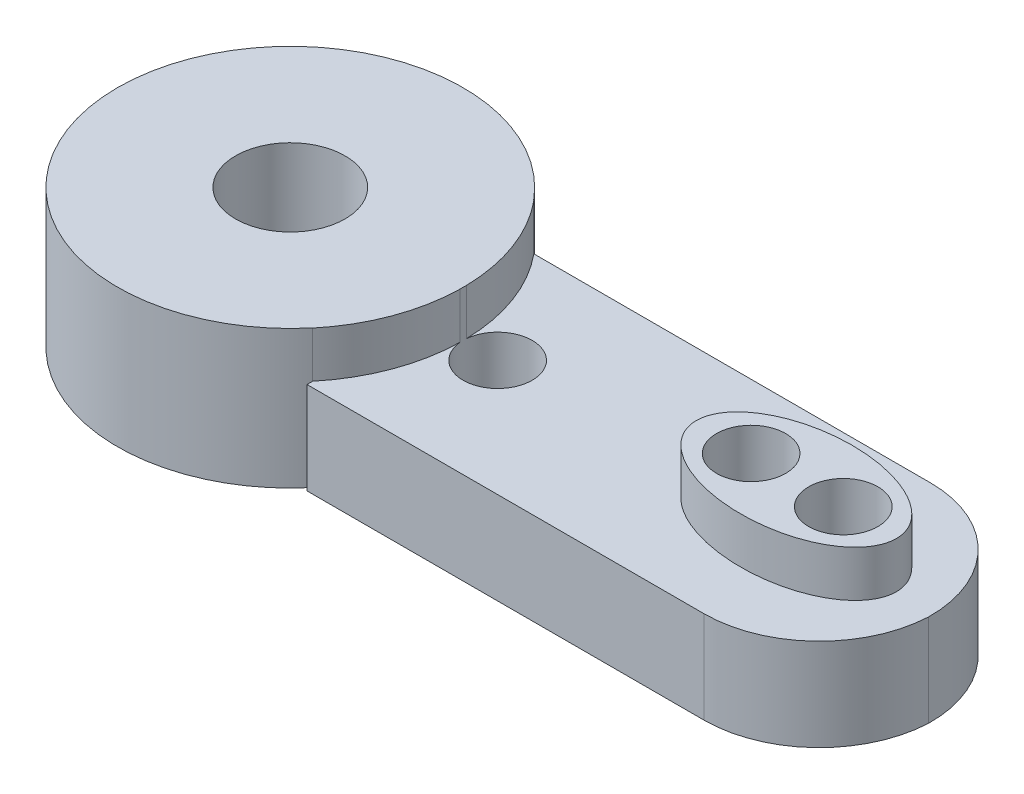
SolidWorks part; units mm, degrees
ref_plane "Front Plane" through (0, 0, 0) normal (0, 0, 1) x (1, 0, 0)
ref_plane "Top Plane" through (0, 0, 0) normal (0, 1, 0) x (1, 0, 0)
ref_plane "Right Plane" through (0, 0, 0) normal (1, 0, 0) x (0, 0, -1)
sketch "Sketch1" plane through (0, 0, 0) normal (0, 1, 0) x (1, 0, 0)
  line L1 (-6.2453, 5.3937) -> (14.568, 5.3937)
  line L2 (-6.2453, -4.1826) -> (-6.2453, -4.4401)
  line L3 (-6.2453, -4.4401) -> (14.3948, -4.4401)
  arc A0 (-6.2453, 5.3937) -> (-6.2453, -4.1826) centre (-12.0179, 0.6056) ccw
  circle A1 centre (-12.0179, 0.6056) radius 2.3755
  circle A2 centre (-3.0179, 0.6056) radius 1.5
  circle A3 centre (7.9821, 0.6056) radius 1.5
  circle A4 centre (11.9821, 0.6056) radius 1.5
  arc A5 (14.3948, -4.4401) -> (14.568, 5.3937) centre (7.1686, 0.6056) ccw
  point P15 (9.3052, 1.2916)
  dimension "D1" = 15
  dimension "D5" = 3
  dimension "D2" = 9
  dimension "D3" = 20
  dimension "D4" = 24
extrude "Boss-Extrude1" add sketch "Sketch1" along normal blind 6
fillet "Fillet3" radius 5 2 edges at (14.568, 3, -5.3937) (14.3948, 3, 4.4401)
sketch "Sketch2" plane through (0, 6, 0) normal (0, 1, 0) x (1, 0, 0)
  line L1 (-27.0921, 13.2332) -> (32.5842, 13.2332)
  line L2 (-27.0921, 13.2332) -> (-27.0921, -14.9235)
  line L3 (-27.0921, -14.9235) -> (32.5842, -14.9235)
  line L4 (32.5842, 13.2332) -> (32.5842, -14.9235)
  circle A0 centre (-12.0179, 0.6056) radius 7.5077
  ellipse E0 centre (9.9443, 0.6056) end of major axis (14.3322, 0.5386) minor radius 2.4998
extrude "Cut-Extrude1" cut sketch "Sketch2" against normal blind 2
